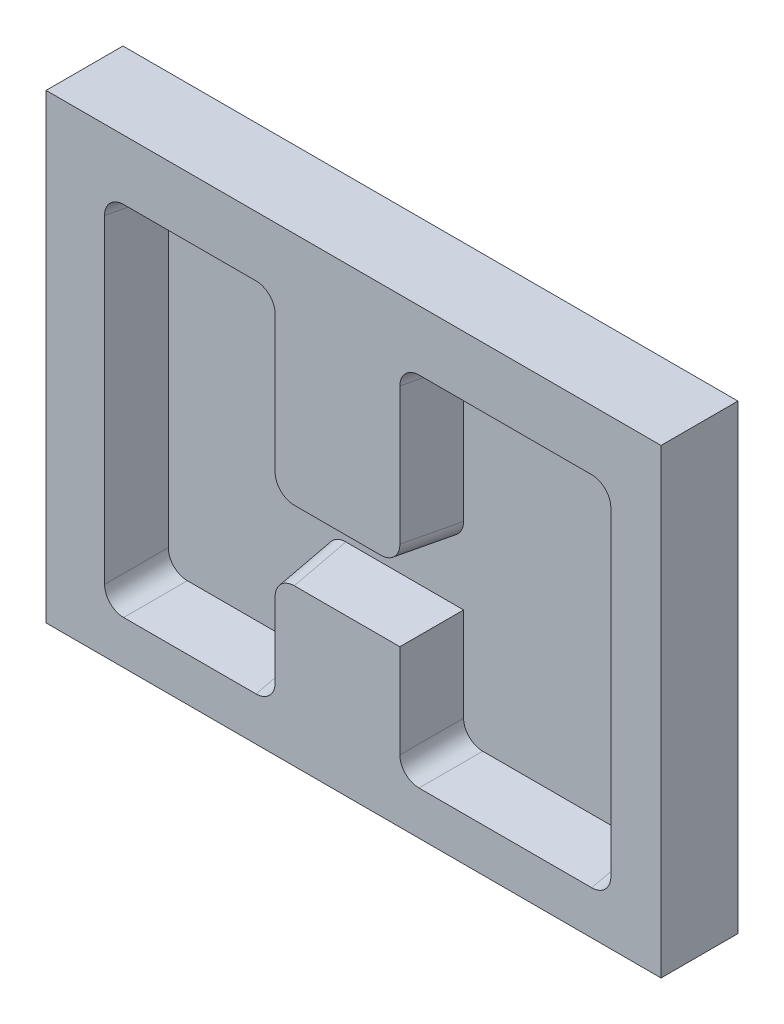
SolidWorks part; units mm, degrees
ref_plane "Front" through (0, 0, 0) normal (0, 0, 1) x (1, 0, 0)
ref_plane "Top" through (0, 0, 0) normal (0, 1, 0) x (1, 0, 0)
ref_plane "Right" through (0, 0, 0) normal (1, 0, 0) x (0, 0, -1)
sketch "Sketch1" plane through (0, 0, 0) normal (0, 0, 1) x (1, 0, 0)
  line L1 (0, 0) -> (203.2, 0)
  line L2 (0, 0) -> (0, 152.4)
  line L3 (0, 152.4) -> (203.2, 152.4)
  line L4 (203.2, 0) -> (203.2, 152.4)
  dimension "D1" = 203.2
  dimension "D2" = 152.4
extrude "Extrude1" add sketch "Sketch1" along normal blind 25.4
sketch "Sketch2" plane through (0, 0, 25.4) normal (0, 0, 1) x (1, 0, 0)
  line L0 (19.3199, 132.5687) -> (75.6886, 132.5687)
  line L1 (75.6886, 132.5687) -> (75.6886, 74.6847)
  line L2 (75.6886, 74.6847) -> (116.9044, 74.6847)
  line L3 (116.9044, 74.6847) -> (116.9044, 132.5687)
  line L4 (116.9044, 132.5687) -> (186.6076, 132.5687)
  line L5 (186.6076, 132.5687) -> (186.6076, 14.3763)
  line L6 (186.6076, 14.3763) -> (116.9044, 14.3763)
  line L7 (116.9044, 14.3763) -> (116.9044, 51.6523)
  line L8 (116.9044, 51.6523) -> (75.6886, 51.6523)
  line L9 (75.6886, 51.6523) -> (75.6886, 14.3763)
  line L10 (75.6886, 14.3763) -> (19.3199, 14.3763)
  line L11 (19.3199, 132.5687) -> (19.3199, 14.3763)
  dimension "D1" = 23.0324
extrude "Cut-Extrude1" cut sketch "Sketch2" against normal blind 19.05 draft 6
fillet "Fillet1" radius 6.35 11 edges at (117.9055, 15.3774, 15.875) (20.321, 15.3774, 15.875) (74.6875, 15.3774, 15.875) (74.6875, 52.6535, 15.875) (185.6065, 15.3774, 15.875) (185.6065, 131.5676, 15.875) (117.9055, 131.5676, 15.875) (117.9055, 73.6836, 15.875) (74.6875, 73.6836, 15.875) (20.321, 131.5676, 15.875) (74.6875, 131.5676, 15.875)
